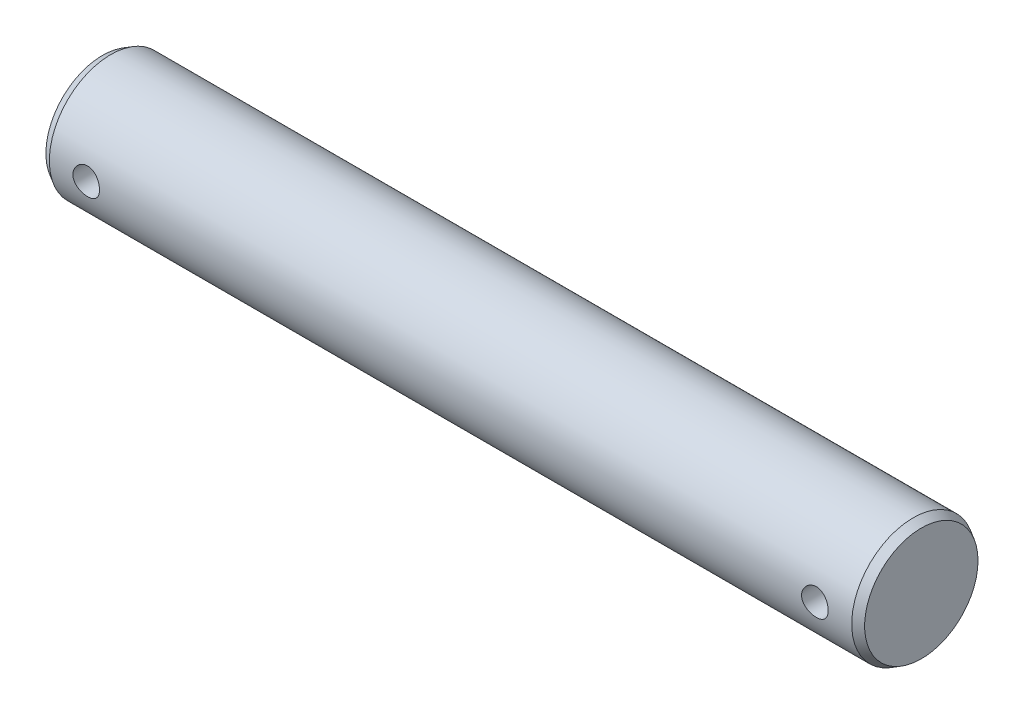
SolidWorks part; units mm, degrees
ref_plane "Plan de face" through (0, 0, 0) normal (0, 0, 1) x (1, 0, 0)
ref_plane "Plan de dessus" through (0, 0, 0) normal (0, 1, 0) x (1, 0, 0)
ref_plane "Plan de droite" through (0, 0, 0) normal (1, 0, 0) x (0, 0, -1)
sketch "Esquisse1" plane through (0, 0, 0) normal (1, 0, 0) x (0, 0, -1)
  circle A0 centre (0, 0) radius 15
  dimension "D1" = 30
extrude "Extrusion1" add sketch "Esquisse1" along normal blind 200
chamfer "Chanfrein1" distance 2 angle 30 2 edges at (200, 0, -15) (0, 0, -15)
sketch "Esquisse2" plane through (0, 0, 0) normal (0, 0, 1) x (1, 0, 0)
  line L0 (-11.5655, 0) -> (208.6752, 0) construction
  line L1 (0, 13.8453) -> (0, -13.8453) construction
  circle A0 centre (11, 0) radius 3.25
  circle A1 centre (189, 0) radius 3.25
  dimension "D1" = 6.5
  dimension "D3" = 6.5
  dimension "D2" = 11
  dimension "D4" = 178
extrude "Extrusion2" cut sketch "Esquisse2" against normal mid plane 48
